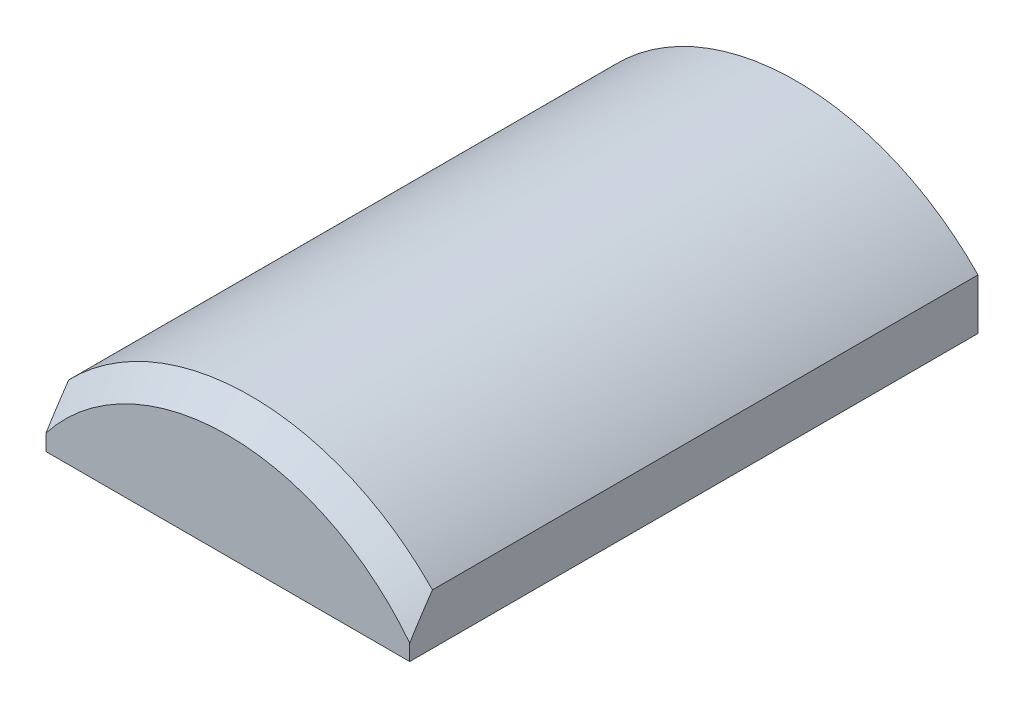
SolidWorks part; units mm, degrees
ref_plane "Front Plane" through (0, 0, 0) normal (0, 0, 1) x (1, 0, 0)
ref_plane "Top Plane" through (0, 0, 0) normal (0, 1, 0) x (1, 0, 0)
ref_plane "Right Plane" through (0, 0, 0) normal (1, 0, 0) x (0, 0, -1)
sketch "Sketch1" plane through (0, 0, 0) normal (0, 0, 1) x (1, 0, 0)
  line L0 (0, 0) -> (0, 69.85) construction
  line L1 (-101.6, 98.1815) -> (-101.6, 69.85)
  line L2 (-101.6, 69.85) -> (101.6, 69.85)
  line L3 (101.6, 69.85) -> (101.6, 98.1815)
  arc A0 (101.6, 98.1815) -> (-101.6, 98.1815) centre (0, 0) ccw
  dimension "D1" = 141.2875
  dimension "D2" = 101.6
  dimension "D3" = 69.85
  dimension "D4" = 101.6
extrude "Boss-Extrude1" add sketch "Sketch1" along normal blind 317.5
chamfer "Chamfer1" distance 12.7 angle 45 1 edges at (0, 141.2875, 317.5)
sketch "Sketch2" plane through (0, 69.85, 0) normal (0, -1, 0) x (1, 0, 0)
  line L1 (-101.6, 0) -> (-57.15, 0)
  line L2 (-101.6, 0) -> (-101.6, 76.2)
  line L3 (-101.6, 76.2) -> (-57.15, 76.2)
  line L4 (-57.15, 0) -> (-57.15, 76.2)
  dimension "D1" = 44.45
  dimension "D2" = 76.2
extrude "Cut-Extrude1" [suppressed] cut sketch "Sketch2" against normal through all
